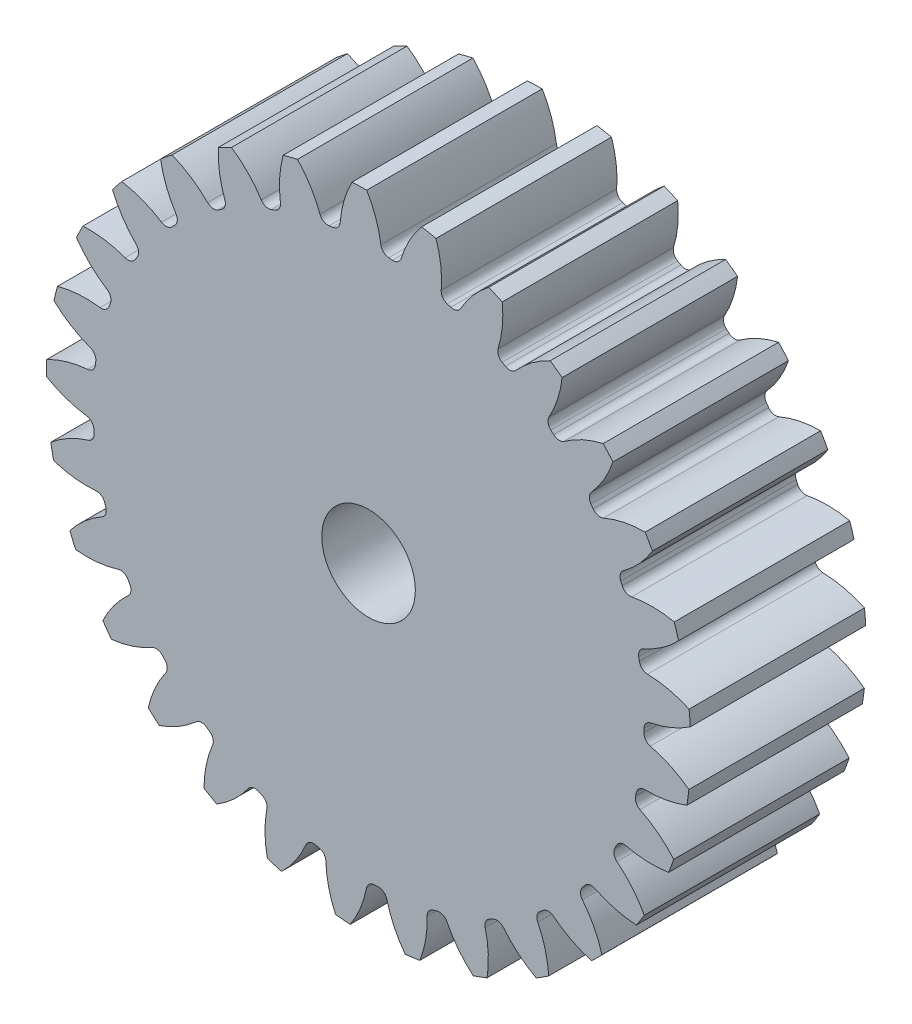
SolidWorks part; units mm, degrees
ref_plane "Front" through (0, 0, 0) normal (0, 0, 1) x (1, 0, 0)
ref_plane "Top" through (0, 0, 0) normal (0, 1, 0) x (1, 0, 0)
ref_plane "Right" through (0, 0, 0) normal (1, 0, 0) x (0, 0, -1)
sketch "Sketch3" plane through (0, 0, 0) normal (0, 0, 1) x (1, 0, 0)
  circle A0 centre (0, 0) radius 174.9778
  dimension "od" = 349.9556
extrude "gearBody" add sketch "Sketch3" along normal blind 95.25
sketch "Sketch2" plane through (0, 0, 0) normal (0, 0, 1) x (1, 0, 0)
  line L0 (0, 0) -> (142.1086, 58.8633) construction
  line L1 (174.2033, -19.6104) -> (0, 0) construction
  line L2 (0, 0) -> (36.3143, 0) construction
  line L3 (163.6228, 4.6527) -> (163.1713, -13.007) construction
  line L5 (163.397, -4.1772) -> (0, 0) construction
  line L7 (0, 0) -> (153.8172, 0) construction
  arc A0 (153.8076, 1.725) -> (153.5185, -9.5817) centre (0, 0) ccw construction
  arc A1 (174.6642, 10.4713) -> (173.901, -19.3822) centre (0, 0) ccw construction
  arc A2 (163.6228, 4.6527) -> (163.1713, -13.007) centre (0, 0) ccw construction
  arc A3 (149.4995, -4.8384) -> (149.5514, -2.8066) centre (0, 0) ccw
  arc A4 (174.2033, -19.6104) -> (152.9834, -9.446) centre (138.9153, -66.0475) ccw
  arc A5 (174.2033, -19.6104) -> (174.9778, 10.6838) centre (0, 0) ccw
  arc A6 (174.9778, 10.6838) -> (153.2662, 1.6169) centre (142.1086, 58.8633) cw
  arc A7 (149.5514, -2.8066) -> (153.2662, 1.6169) centre (154.1452, -2.8929) cw
  arc A8 (152.9834, -9.446) -> (149.4995, -4.8384) centre (154.0917, -4.9871) cw
  point P6 (174.9778, 10.6838)
  point P22 (174.2033, -19.6104)
  dimension "baseDia" = 307.6345
  dimension "od" = 349.9556
  dimension "pd" = 327.3778
  dimension "rd" = 299.1556
  dimension "rFillet" = 4.5946
  dimension "pointX" = 174.9778
  dimension "pointY" = 10.6838
  dimension "CTT" = 17.6597
  dimension "flankCenterAngle" = 22.5
extrude "toothCut" cut sketch "Sketch2" along normal through all
pattern_circular "CirPattern1" count 29 over 360 about axis through (0, 0, 0) along (0, 0, 1) of "toothCut"
sketch "hub1Dia" plane through (0, 0, 0) normal (0, 0, -1) x (-1, 0, 0)
  circle A0 centre (0, 0) radius 12.7
  dimension "hub1Dia" = 25.4
sketch "hub2Dia" plane through (0, 0, 95.25) normal (0, 0, 1) x (1, 0, 0)
  circle A0 centre (0, 0) radius 12.7
  dimension "hub2dia" = 25.4
sketch "boreDia" plane through (0, 0, 0) normal (0, 0, 1) x (1, 0, 0)
  circle A0 centre (0, 0) radius 25.4
  dimension "boreDia" = 50.8
extrude "bore" cut sketch "boreDia" against normal mid plane 25400
